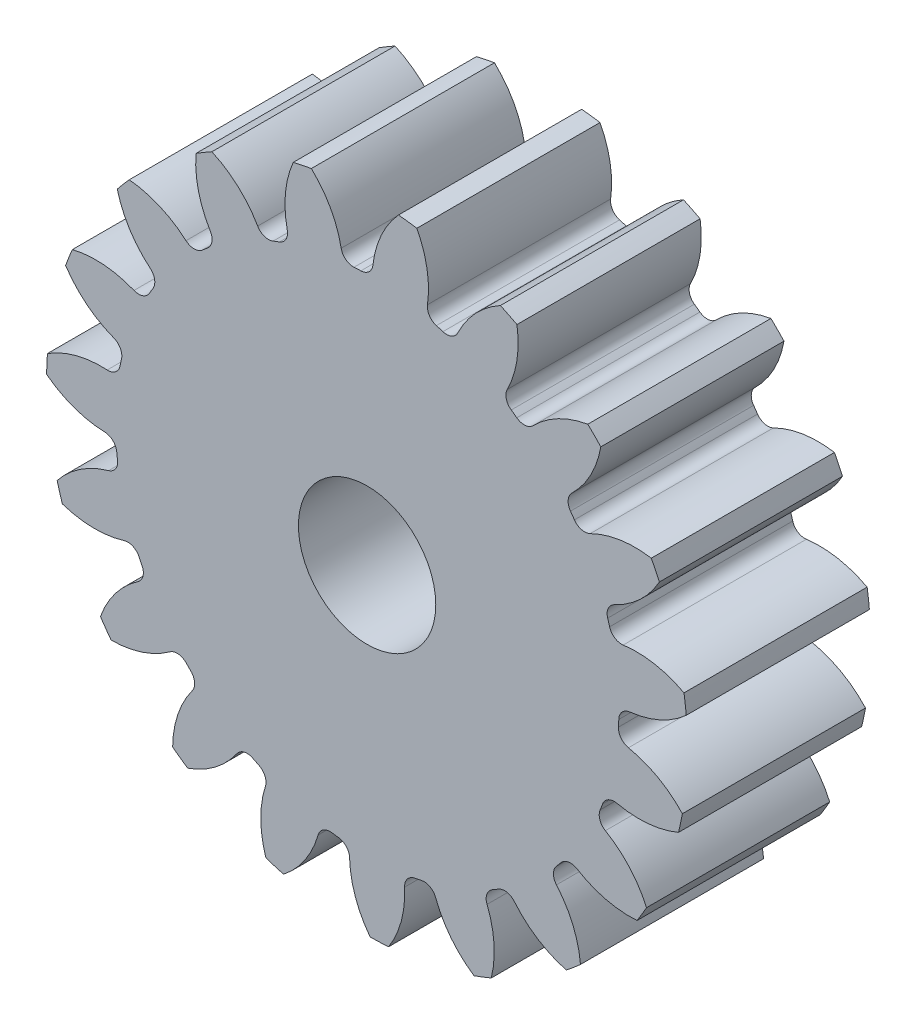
SolidWorks part; units mm, degrees
ref_plane "Front" through (0, 0, 0) normal (0, 0, 1) x (1, 0, 0)
ref_plane "Top" through (0, 0, 0) normal (0, 1, 0) x (1, 0, 0)
ref_plane "Right" through (0, 0, 0) normal (1, 0, 0) x (0, 0, -1)
sketch "Sketch3" plane through (0, 0, 0) normal (0, 0, 1) x (1, 0, 0)
  circle A0 centre (0, 0) radius 177.8
  dimension "od" = 355.6
extrude "gearBody" add sketch "Sketch3" along normal blind 101.6
sketch "Sketch2" plane through (0, 0, 0) normal (0, 0, 1) x (1, 0, 0)
  line L0 (0, 0) -> (139.6585, 57.8484) construction
  line L1 (175.5899, -32.7388) -> (0, 0) construction
  line L2 (0, 0) -> (36.3143, 0) construction
  line L3 (160.7496, 6.1358) -> (159.5738, -20.3538) construction
  line L5 (160.1617, -7.109) -> (0, 0) construction
  line L7 (0, 0) -> (151.1652, 0) construction
  arc A0 (151.1315, 3.1913) -> (150.2545, -16.5687) centre (0, 0) ccw construction
  arc A1 (177.0457, 16.3607) -> (174.8999, -31.9823) centre (0, 0) ccw construction
  arc A2 (160.7496, 6.1358) -> (159.5738, -20.3538) centre (0, 0) ccw construction
  arc A3 (139.4658, -8.0853) -> (139.6337, -4.3029) centre (0, 0) ccw
  arc A4 (175.5899, -32.7388) -> (144.9882, -15.2409) centre (133.984, -69.9944) ccw
  arc A5 (175.5899, -32.7388) -> (177.8, 17.0532) centre (0, 0) ccw
  arc A6 (177.8, 17.0532) -> (145.7683, 2.3354) centre (139.6585, 57.8484) cw
  arc A7 (139.6337, -4.3029) -> (145.7683, 2.3354) centre (146.5223, -4.5151) cw
  arc A8 (144.9882, -15.2409) -> (139.4658, -8.0853) centre (146.3461, -8.4842) cw
  point P6 (177.8, 17.0532)
  point P22 (175.5899, -32.7388)
  dimension "baseDia" = 302.3304
  dimension "od" = 355.6
  dimension "pd" = 321.7333
  dimension "rd" = 279.4
  dimension "rFillet" = 6.8919
  dimension "pointX" = 177.8
  dimension "pointY" = 17.0532
  dimension "CTT" = 26.4896
  dimension "flankCenterAngle" = 22.5
extrude "toothCut" cut sketch "Sketch2" along normal through all
pattern_circular "CirPattern1" count 19 over 360 about axis through (0, 0, 0) along (0, 0, 1) of "toothCut"
sketch "hub1Dia" plane through (0, 0, 0) normal (0, 0, -1) x (-1, 0, 0)
  circle A0 centre (0, 0) radius 12.7
  dimension "hub1Dia" = 25.4
sketch "hub2Dia" plane through (0, 0, 101.6) normal (0, 0, 1) x (1, 0, 0)
  circle A0 centre (0, 0) radius 12.7
  dimension "hub2dia" = 25.4
sketch "boreDia" plane through (0, 0, 0) normal (0, 0, 1) x (1, 0, 0)
  circle A0 centre (0, 0) radius 38.1
  dimension "boreDia" = 76.2
extrude "bore" cut sketch "boreDia" against normal mid plane 25400
